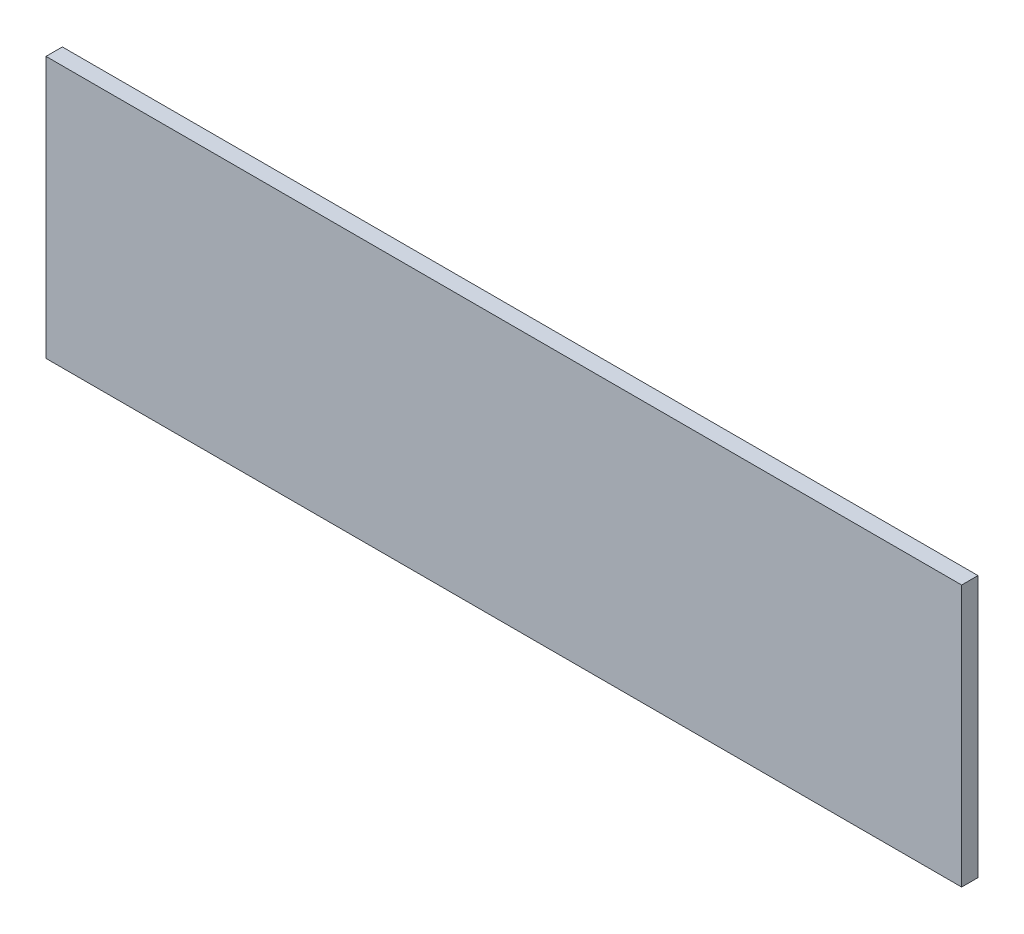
SolidWorks part; units mm, degrees
ref_plane "Face" through (0, 0, 0) normal (0, 0, 1) x (1, 0, 0)
ref_plane "Dessus" through (0, 0, 0) normal (0, 1, 0) x (1, 0, 0)
ref_plane "Droite" through (0, 0, 0) normal (1, 0, 0) x (0, 0, -1)
sketch "Esquisse1" plane through (0, 0, 0) normal (0, 0, 1) x (1, 0, 0)
  line L1 (0, 0) -> (280, 0)
  line L2 (0, 0) -> (0, 80)
  line L3 (0, 80) -> (280, 80)
  line L4 (280, 0) -> (280, 80)
  dimension "D1" = 80
  dimension "D2" = 280
extrude "Base-Extrusion" add sketch "Esquisse1" along normal blind 5
